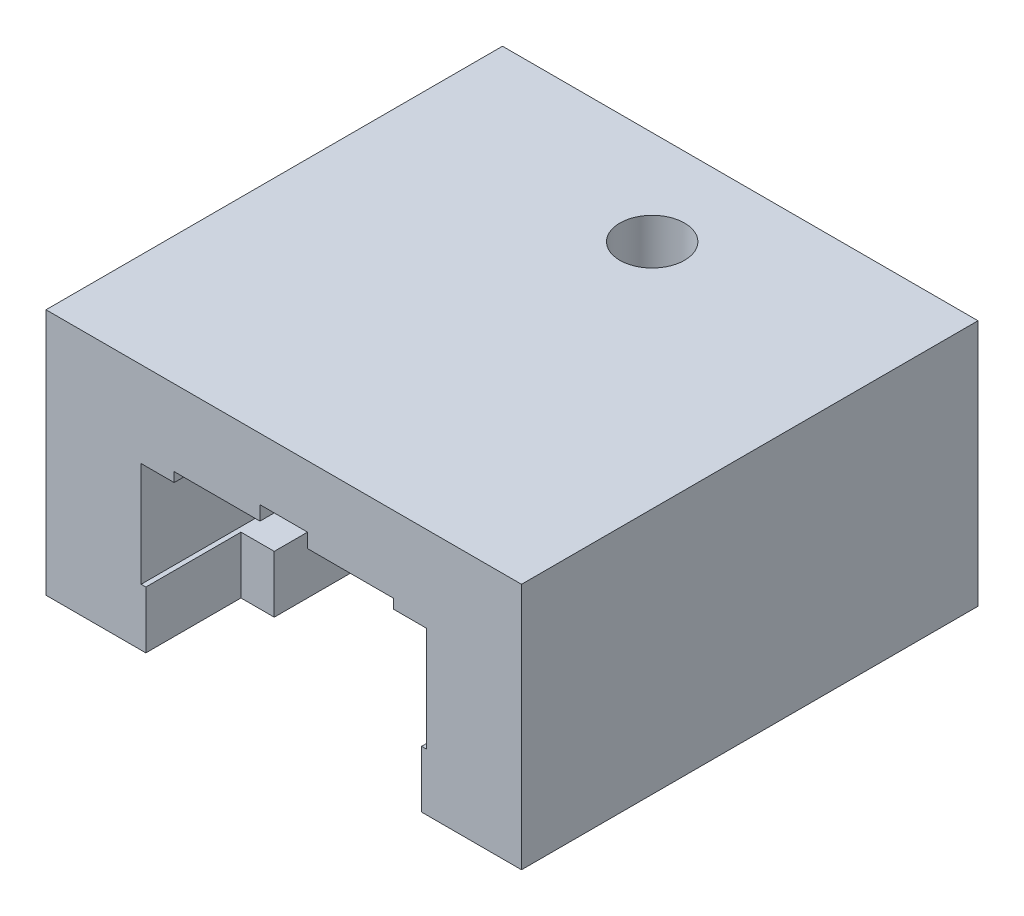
SolidWorks part; units mm, degrees
ref_plane "Plan1" through (0, 0, 0) normal (0, 0, 1) x (1, 0, 0)
ref_plane "Plan2" through (0, 0, 0) normal (0, 1, 0) x (1, 0, 0)
ref_plane "Plan3" through (0, 0, 0) normal (1, 0, 0) x (0, 0, -1)
sketch "Esquisse1" plane through (0, 0, 0) normal (0, 0, 1) x (1, 0, 0)
  line L0 (-25, 0) -> (25, 0)
  line L1 (-25, 0) -> (-25, -26)
  line L2 (-25, -26) -> (-11, -26)
  line L3 (-11, -26) -> (-11, -20)
  line L4 (-11, -20) -> (-15, -20)
  line L5 (-15, -20) -> (-15, -9)
  line L6 (-15, -9) -> (15, -9)
  line L7 (25, 0) -> (25, -26)
  line L8 (25, -26) -> (11, -26)
  line L9 (11, -26) -> (11, -20)
  line L10 (11, -20) -> (15, -20)
  line L11 (15, -20) -> (15, -9)
  line L12 (0, 80) -> (0, -70) construction
  point P8 (0, 0)
  point P18 (0, -9)
  dimension "D1" = 25
  dimension "D2" = 26
  dimension "D3" = 14
  dimension "D4" = 10
  dimension "D5" = 9
  dimension "D6" = 6
extrude "Base-Extrusion" add sketch "Esquisse1" along normal blind 48
sketch "Esquisse3" plane through (0, -26, 0) normal (0, -1, 0) x (1, 0, 0)
  line L0 (11, 48) -> (11, 0) construction
  line L1 (-11, 48) -> (-11, 0) construction
  line L3 (-15, 0) -> (15, 0) construction
  circle A0 centre (11, 24) radius 5
  circle A1 centre (-11, 24) radius 5
  dimension "D1" = 10
  dimension "D2" = 10
  dimension "D3" = 24
extrude "Enlèv. mat.-Extru.2" cut sketch "Esquisse3" against normal blind 6
sketch "Esquisse5" plane through (0, -9, 0) normal (0, -1, 0) x (1, 0, 0)
  line L0 (11.5245, 25) -> (11.5245, 51.7476)
  line L1 (-11.5245, 25) -> (-11.5245, 51.7476)
  line L2 (11.5245, 51.7476) -> (-11.5245, 51.7476)
  line L5 (-15, 48) -> (15, 48) construction
  arc A0 (-11.5245, 25) -> (11.5245, 25) centre (0, 25) ccw
  dimension "D1" = 23
extrude "Enlèv. mat.-Extru.3" cut sketch "Esquisse5" against normal blind 1
sketch "Esquisse6" plane through (0, -8, 0) normal (0, -1, 0) x (1, 0, 0)
  line L0 (2.5, 40) -> (2.5, 51.0281)
  line L1 (-2.5, 40) -> (-2.5, 51.5955)
  line L2 (2.5, 51.0281) -> (-2.5, 51.5955)
  line L3 (0, -2.1302) -> (0, 54.6287) construction
  line L4 (-11.5245, 48) -> (11.5245, 48) construction
  arc A0 (-2.5, 40) -> (2.5, 40) centre (0, 40) ccw
  dimension "D1" = 5
  dimension "D2" = 8
extrude "Enlèv. mat.-Extru.4" cut sketch "Esquisse6" against normal blind 1.5
sketch "Esquisse7" plane through (0, -26, 0) normal (0, -1, 0) x (1, 0, 0)
  line L0 (25, 48) -> (25, 0) construction
  line L1 (16, 8) -> (-16, 8)
  line L2 (16, 8) -> (16, -8.4017)
  line L3 (16, -8.4017) -> (-16, -8.4017)
  line L4 (-16, 8) -> (-16, -8.4017)
  line L6 (11, 0) -> (25, 0) construction
  dimension "D1" = 32
  dimension "D2" = 9
  dimension "D3" = 8
extrude "Enlèv. mat.-Extru.5" cut sketch "Esquisse7" against normal blind 18
sketch "Esquisse9" plane through (0, -26, 0) normal (0, -1, 0) x (1, 0, 0)
  line L0 (25, 48) -> (25, 0) construction
  line L1 (14.5, 38) -> (-14.5, 38)
  line L2 (14.5, 38) -> (14.5, 53.9571)
  line L3 (14.5, 53.9571) -> (-14.5, 53.9571)
  line L4 (-14.5, 38) -> (-14.5, 53.9571)
  line L5 (2.5, 48) -> (11.5245, 48) construction
  dimension "D1" = 29
  dimension "D2" = 10.5
  dimension "D3" = 10
extrude "Enlèv. mat.-Extru.6" cut sketch "Esquisse9" against normal blind 17
fillet "Congé4" radius 3 2 edges at (16, -8, 4) (-16, -8, 4)
hole_wizard "Perçage1" positions "Esquisse11" profile "Esquisse10" tap size "M8x1.25" standard "ISO"
sketch "Esquisse11" plane through (0, 0, 0) normal (0, 1, 0) x (-1, 0, 0)
  point P0 (-0.6713, 9.9292)
sketch "Esquisse10" plane through (0.6713, 0, 9.9292) normal (1, 0, 0) x (0, 0, 1)
  line L0 (0, 0) -> (0, 9)
  line L1 (0, 9) -> (3.4, 9)
  line L2 (3.4, 9) -> (3.4, 0)
  line L5 (3.4, 0) -> (0, 0)
  line L11 (0, -6.35) -> (0, 107.95) construction
  dimension "Diamètre du perçage jusqu'au prochain" = 6.8
  dimension "Profondeur du perçage jusqu'au prochain" = 9
